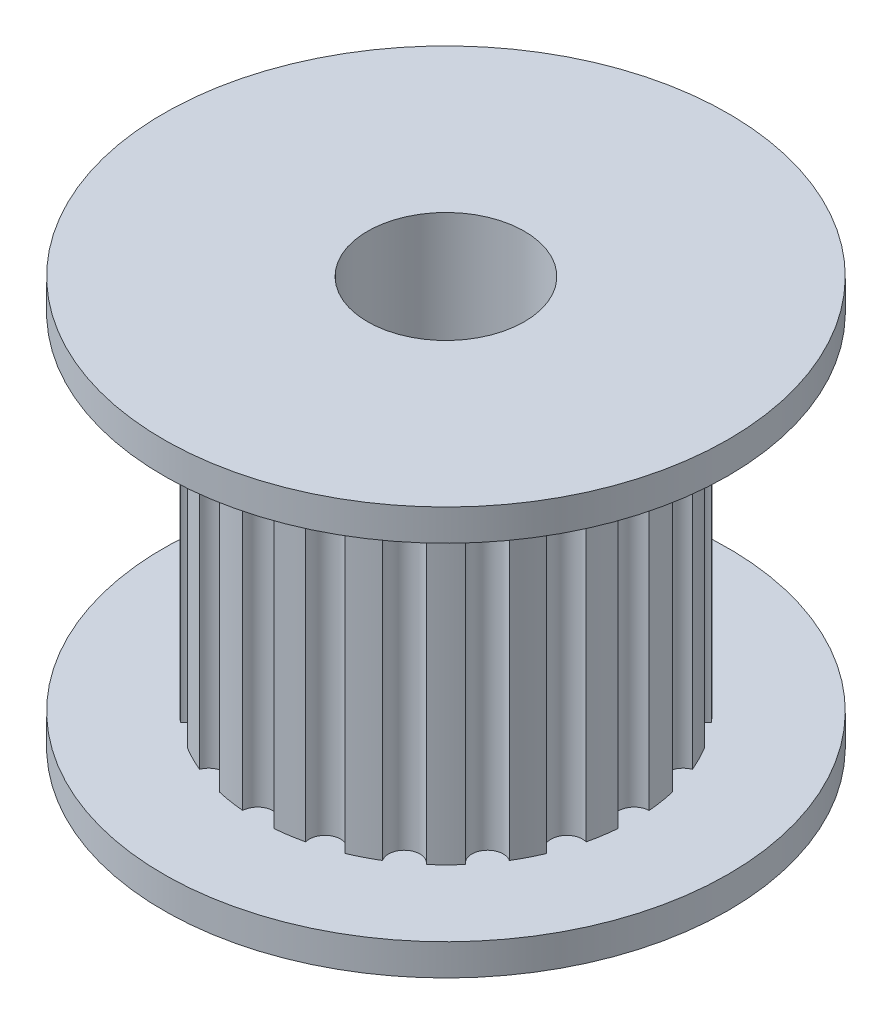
SolidWorks part; units mm, degrees
ref_plane "Ebene vorne" through (0, 0, 0) normal (0, 0, 1) x (1, 0, 0)
ref_plane "Ebene oben" through (0, 0, 0) normal (0, 1, 0) x (1, 0, 0)
ref_plane "Ebene rechts" through (0, 0, 0) normal (1, 0, 0) x (0, 0, -1)
sketch "Skizze1" plane through (0, 0, 0) normal (0, 0, 1) x (1, 0, 0)
  line L0 (2.5, -6.5) -> (2.5, 6.5)
  line L1 (2.5, 6.5) -> (9, 6.5)
  line L2 (9, 6.5) -> (9, 5.5)
  line L3 (9, 5.5) -> (6, 5.5)
  line L4 (6, 5.5) -> (6, -5.5)
  line L5 (6, -5.5) -> (9, -5.5)
  line L6 (9, -5.5) -> (9, -6.5)
  line L7 (9, -6.5) -> (2.5, -6.5)
  line L8 (0, -6.5) -> (0, 6.5) construction
  point P10 (0, 0)
  dimension "D1" = 5
  dimension "D2" = 13
  dimension "D3" = 11
  dimension "D4" = 18
  dimension "D5" = 12
revolve "Rotation1" add sketch "Skizze1" angle 360 about L8
sketch "Skizze2" plane through (0, -5.5, 0) normal (0, 1, 0) x (1, 0, 0)
  arc A0 (-0.4996, 5.9792) -> (0.4996, 5.9792) centre (0, 6) ccw
  circle A1 centre (0, 0) radius 6 construction
  arc A2 (0.4996, 5.9792) -> (-0.4996, 5.9792) centre (0, 0) ccw
  dimension "D1" = 0.5
extrude "Schnitt-Linear austragen1" cut sketch "Skizze2" along normal up to surface (11 mm away)
pattern_circular "Kreismuster1" count 20 over 360 about axis through (0, 0, 0) along (0, 1, 0) of "Schnitt-Linear austragen1"
